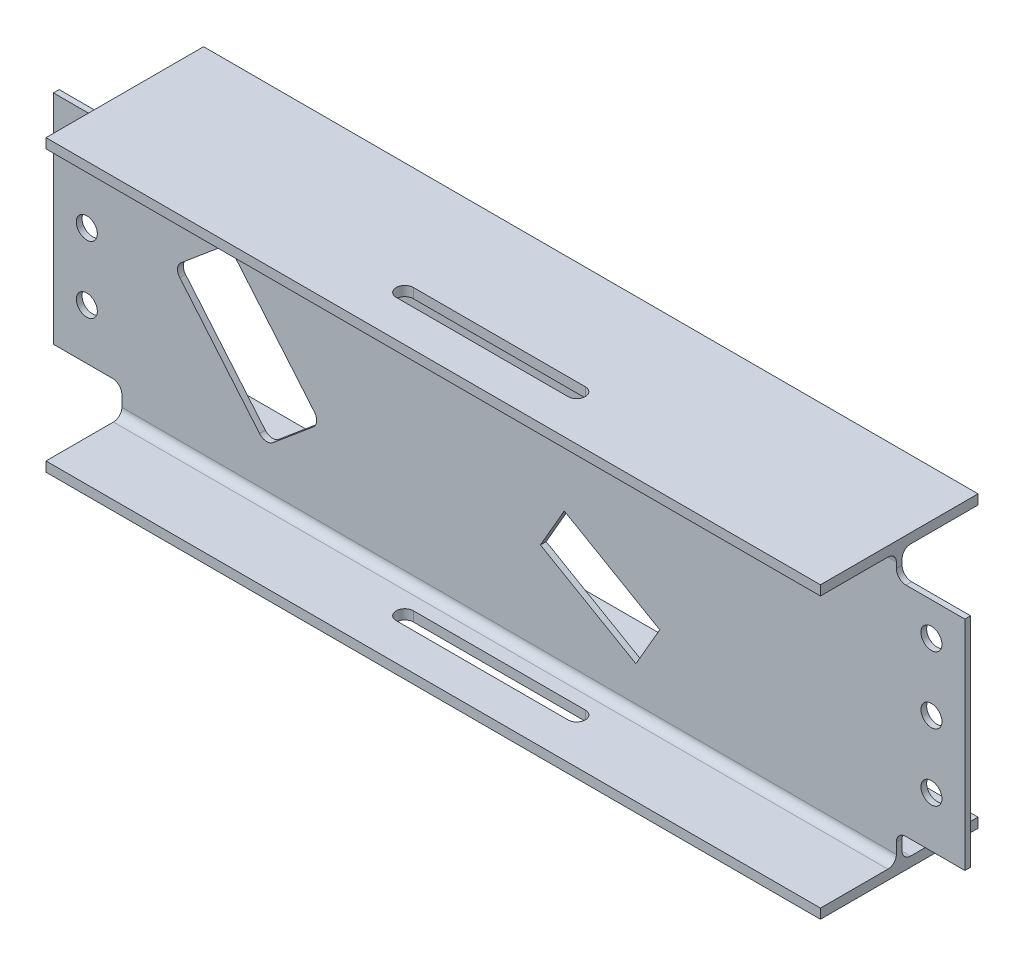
SolidWorks part; units mm, degrees
ref_plane "Front Plane" through (0, 0, 0) normal (0, 0, 1) x (1, 0, 0)
ref_plane "Top Plane" through (0, 0, 0) normal (0, 1, 0) x (1, 0, 0)
ref_plane "Right Plane" through (0, 0, 0) normal (1, 0, 0) x (0, 0, -1)
sketch "Member Sketch" plane through (0, 0, 0) normal (0, 1, 0) x (1, 0, 0)
  line L0 (0, 0) -> (1000, 0)
  line L2 (0, 0) -> (1000, 0) construction
other "Structural Member1"
ref_plane "Plane1" through (0, 0, 0) normal (1, 0, 0) x (0, 0, -1)
sketch "Sketch19" plane through (0, -151.7, 0) normal (1, 0, 0) x (0, 0, -1)
  line L0 (-82.5, 151.7) -> (82.5, 151.7)
  line L1 (82.5, 151.7) -> (82.5, 141.5)
  line L2 (82.5, 141.5) -> (11.9, 141.5)
  line L3 (3, 132.6) -> (3, -132.6)
  line L4 (-3, 0) -> (3, 0) construction
  line L5 (0, -151.7) -> (0, 151.7) construction
  line L6 (-3, 132.6) -> (-3, -132.6)
  line L7 (-82.5, 141.5) -> (-11.9, 141.5)
  line L8 (-82.5, 151.7) -> (-82.5, 141.5)
  line L9 (-82.5, -151.7) -> (-82.5, -141.5)
  line L10 (-82.5, -141.5) -> (-11.9, -141.5)
  line L11 (82.5, -141.5) -> (11.9, -141.5)
  line L12 (82.5, -151.7) -> (82.5, -141.5)
  line L13 (-82.5, -151.7) -> (82.5, -151.7)
  line L14 (-82.5, 141.5) -> (-82.5, -141.5) construction
  line L15 (82.5, 141.5) -> (82.5, -141.5) construction
  line L16 (-3, 0) -> (-82.5, 0) construction
  line L17 (3, 0) -> (82.5, 0) construction
  arc A0 (11.9, 141.5) -> (3, 132.6) centre (11.9, 132.6) ccw
  arc A3 (-11.9, 141.5) -> (-3, 132.6) centre (-11.9, 132.6) cw
  arc A4 (-11.9, -141.5) -> (-3, -132.6) centre (-11.9, -132.6) ccw
  arc A7 (11.9, -141.5) -> (3, -132.6) centre (11.9, -132.6) cw
  point P18 (0, 0)
  dimension "Root Radius(r)" = 8.9
  dimension "Section Depth(D)" = 303.4
  dimension "Flange Width(B)" = 165
  dimension "Web Thickness(t)" = 6
  dimension "Flange Thickness(T)" = 10.2
sketch "Sketch2" plane through (0, 0, 0) normal (0, 1, 0) x (1, 0, 0)
  line L0 (500, 0) -> (1500, 0) construction
  line L1 (0, -90.75) -> (0, 90.75) construction
  line L2 (-166.87, 0) -> (166.87, 0) construction
  text T0 "UB 305x165x40" font "Century Gothic" height 30
  dimension "D1" = 500
  dimension "D2" = 1000
extrude "MARKING" [suppressed] cut sketch "Sketch2" against normal blind 1
other "0008-AABE004-CN02-FP01D01-1 - MEMBER2 CAVITY"
other "0008-AABE004<1>@0008-AA/0008-AABE004-CN02-FP01<1>@0008-AABE004/0008-AABE004-CN02-FP01D01<1>@0008-AABE004-CN02-FP011"
other "0008-AABE004-CN02-FP01D02-1 - MEMBER2 CAVITY"
other "0008-AABE004<1>@0008-AA/0008-AABE004-CN02-FP01<1>@0008-AABE004/0008-AABE004-CN02-FP01D02<1>@0008-AABE004-CN02-FP011"
other "0008-AABE002-CN01-FP02D01-1 - MEMBER2 CAVITY"
other "0008-AABE002<1>@0008-AA/0008-AABE002-CN01-FP02<1>@0008-AABE002/0008-AABE002-CN01-FP02D01<1>@0008-AABE002-CN01-FP021"
other "0008-AABE002-CN01-FP02D02-1 - MEMBER2 CAVITY"
other "0008-AABE002<1>@0008-AA/0008-AABE002-CN01-FP02<1>@0008-AABE002/0008-AABE002-CN01-FP02D02<1>@0008-AABE002-CN01-FP021"
sketch "Sketch12" plane through (0, 0, -3) normal (0, 0, -1) x (-1, 0, 0)
  line L0 (-657.75, -204.4338) -> (-557.75, -146.6987)
  line L1 (-657.75, -204.4338) -> (-632.75, -247.735)
  line L2 (-557.75, -146.6987) -> (-532.75, -190)
  line L3 (-632.75, -247.735) -> (-532.75, -190)
  line L4 (-22.75, -263) -> (-22.75, -35) construction
  line L5 (-905.5, -303.4) -> (-94.5, -303.4) construction
  line L6 (-905.5, 0) -> (-94.5, 0) construction
  line L7 (-296.1053, -187.8046) -> (-212.5429, -88.2188)
  line L8 (-294.8727, -201.8929) -> (-252.7403, -237.2462)
  line L9 (-198.4546, -86.9862) -> (-156.3221, -122.3396)
  line L10 (-238.6519, -236.0137) -> (-155.0896, -136.4279)
  arc A0 (-238.6519, -236.0137) -> (-252.7403, -237.2462) centre (-246.3124, -229.5858) cw
  arc A1 (-294.8727, -201.8929) -> (-296.1053, -187.8046) centre (-288.4448, -194.2325) cw
  arc A2 (-198.4546, -86.9862) -> (-212.5429, -88.2188) centre (-204.8824, -94.6467) ccw
  arc A3 (-156.3221, -122.3396) -> (-155.0896, -136.4279) centre (-162.75, -130) cw
  dimension "D6" = 10
  dimension "D1" = 510
  dimension "D2" = 100
  dimension "D3" = 30
  dimension "D4" = 50
  dimension "D5" = 190
  dimension "D7" = 140
  dimension "D8" = 50
  dimension "D9" = 130
  dimension "D10" = 75
  dimension "D11" = 150
extrude "Cut-Extrude1" cut sketch "Sketch12" against normal through all
sketch "Sketch13" plane through (0, 0, 0) normal (0, 1, 0) x (1, 0, 0)
  line L0 (422.75, -35) -> (602.75, -35) construction
  line L1 (422.75, -26) -> (602.75, -26)
  line L2 (422.75, -44) -> (602.75, -44)
  line L3 (-166.87, 0) -> (166.87, 0) construction
  arc A0 (422.75, -26) -> (422.75, -44) centre (422.75, -35) ccw
  arc A1 (602.75, -44) -> (602.75, -26) centre (602.75, -35) ccw
  point P2 (512.75, -35)
  dimension "D1" = 18
  dimension "D2" = 180
  dimension "D3" = 400
  dimension "D4" = 35
extrude "Cut-Extrude2" cut sketch "Sketch13" against normal through all
